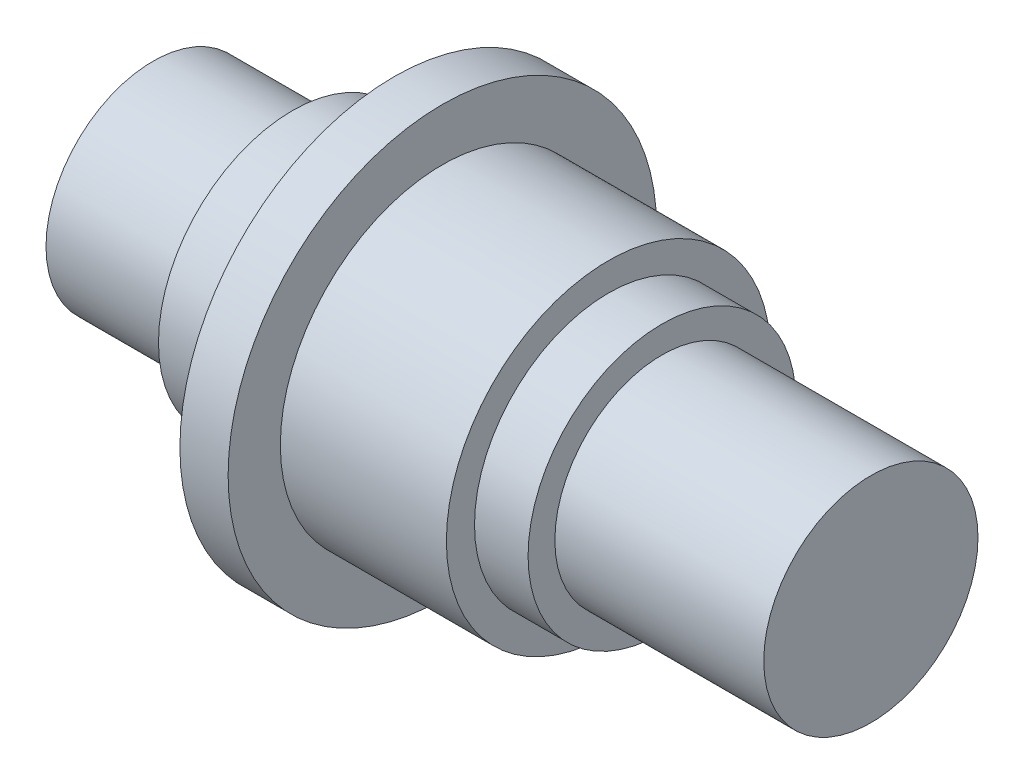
SolidWorks part; units mm, degrees
ref_plane "Plano frontal" through (0, 0, 0) normal (0, 0, 1) x (1, 0, 0)
ref_plane "Plano superior" through (0, 0, 0) normal (0, 1, 0) x (1, 0, 0)
ref_plane "Plano direito" through (0, 0, 0) normal (1, 0, 0) x (0, 0, -1)
sketch "Esboço1" plane through (0, 0, 0) normal (1, 0, 0) x (0, 0, -1)
  circle A0 centre (0, 0) radius 2
  dimension "D1" = 4
extrude "Ressalto-extrusão1" add sketch "Esboço1" along normal blind 7.35 and the other way blind 6.05
ref_plane "Plano2" through (0.85, 0, 0) normal (1, 0, 0) x (0, 0, -1)
sketch "Esboço3" plane through (0.85, 0, 0) normal (1, 0, 0) x (0, 0, -1)
  circle A0 centre (0, 0) radius 3.025
  dimension "D1" = 6.05
extrude "Ressalto-extrusão3" add sketch "Esboço3" along normal mid plane 3.2
sketch "Esboço2" plane through (0, 0, 0) normal (-1, 0, 0) x (0, 0, 1)
  circle A0 centre (0, 0) radius 2.5
  circle A1 centre (0, 0) radius 2 construction
  dimension "D1" = 5
extrude "Ressalto-extrusão2" add sketch "Esboço2" along normal mid plane 6.9
mirror "Espelhar1" about plane through (0, 0, 0) normal (1, 0, 0) of "Ressalto-extrusão2"
sketch "Esboço4" plane through (-0.75, 0, 0) normal (-1, 0, 0) x (0, 0, 1)
  circle A0 centre (0, 0) radius 4
  dimension "D1" = 8
extrude "Ressalto-extrusão4" add sketch "Esboço4" along normal blind 0.8 and the other way blind 0.1
